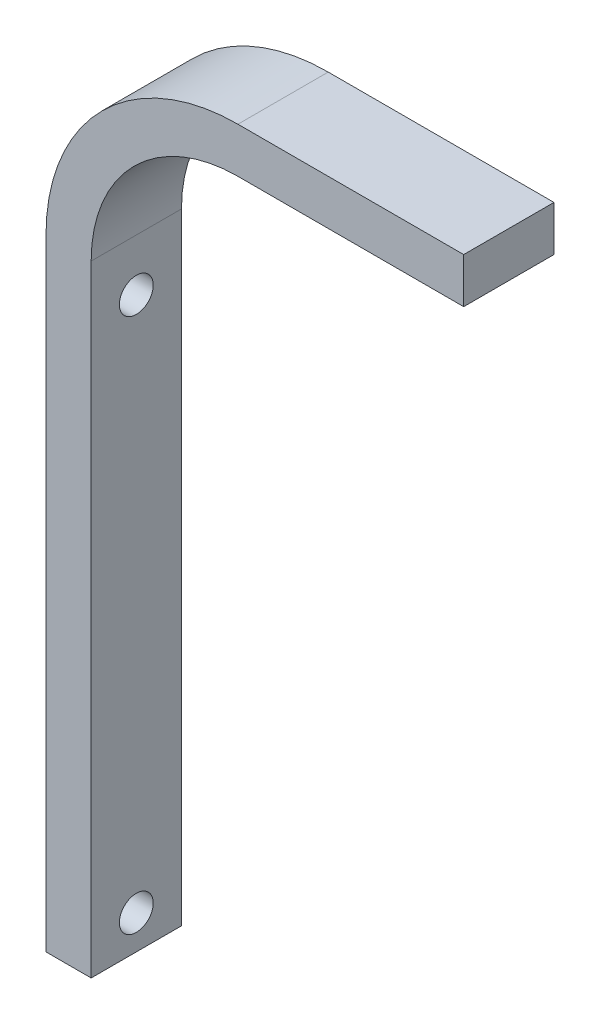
SolidWorks part; units mm, degrees
ref_plane "Plan de face" through (0, 0, 0) normal (0, 0, 1) x (1, 0, 0)
ref_plane "Plan de dessus" through (0, 0, 0) normal (0, 1, 0) x (1, 0, 0)
ref_plane "Plan de droite" through (0, 0, 0) normal (1, 0, 0) x (0, 0, -1)
sketch "Esquisse1" plane through (0, 0, 0) normal (0, 0, 1) x (1, 0, 0)
  line L0 (0, 0) -> (0, 55)
  line L1 (17, 72) -> (37, 72)
  line L2 (37, 72) -> (37, 68)
  line L3 (37, 68) -> (17, 68)
  line L4 (4, 55) -> (4, 0)
  line L5 (4, 0) -> (0, 0)
  arc A0 (0, 55) -> (17, 72) centre (17, 55) cw
  arc A1 (17, 68) -> (4, 55) centre (17, 55) ccw
  dimension "D7" = 13
  dimension "D1" = 20
  dimension "D2" = 55
  dimension "D3" = 55
  dimension "D4" = 20
  dimension "D5" = 4
extrude "Boss.-Extru.1" add sketch "Esquisse1" along normal blind 8
sketch "Esquisse2" plane through (0, 0, 0) normal (-1, 0, 0) x (0, 0, 1)
  line L0 (8, 55) -> (8, 0) construction
  line L1 (8, 0) -> (0, 0) construction
  circle A0 centre (4, 3) radius 1.5
  circle A1 centre (4, 50.4087) radius 1.5
  dimension "D3" = 3
  dimension "D4" = 3
  dimension "D1" = 4
  dimension "D2" = 3
  dimension "D5" = 4
extrude "Enlèv. mat.-Extru.1" cut sketch "Esquisse2" against normal through all and the other way through all
